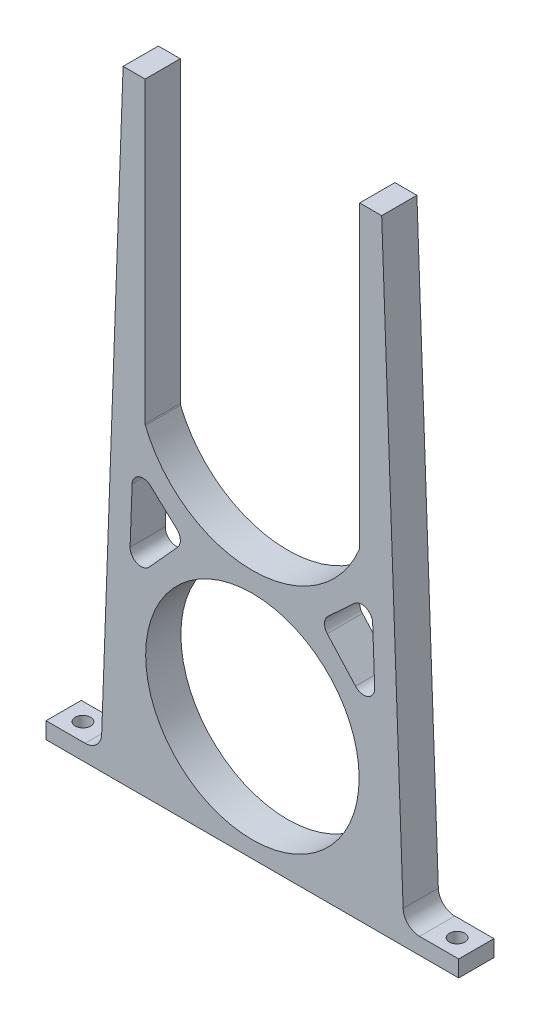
SolidWorks part; units mm, degrees
ref_plane "Front Plane" through (0, 0, 0) normal (0, 0, 1) x (1, 0, 0)
ref_plane "Top Plane" through (0, 0, 0) normal (0, 1, 0) x (1, 0, 0)
ref_plane "Right Plane" through (0, 0, 0) normal (1, 0, 0) x (0, 0, -1)
sketch "Sketch1" plane through (0, 0, 0) normal (0, 0, 1) x (1, 0, 0)
  line L0 (0, 0) -> (0, 93.2102) construction
  line L1 (-37.5, 0) -> (37.5, 0)
  line L2 (37.5, 0) -> (37.5, 3)
  line L3 (37.5, 3) -> (27.5, 3)
  line L4 (27.5, 3) -> (23.5, 113)
  line L5 (23.5, 113) -> (19.5, 113)
  line L6 (19.5, 113) -> (19.5, 58.6058)
  line L7 (-19.5, 113) -> (-19.5, 58.6058)
  line L8 (-23.5, 113) -> (-19.5, 113)
  line L9 (-27.5, 3) -> (-23.5, 113)
  line L10 (-37.5, 3) -> (-27.5, 3)
  line L11 (-37.5, 0) -> (-37.5, 3)
  arc A0 (19.5, 58.6058) -> (-19.5, 58.6058) centre (0, 66.4) cw
  circle A1 centre (0, 22.4) radius 19.4
  dimension "D4" = 21
  dimension "D8" = 19.4
  dimension "D10" = 44
  dimension "D1" = 4
  dimension "D2" = 3
  dimension "D3" = 37.5
  dimension "D5" = 110
  dimension "D6" = 19.5
  dimension "D7" = 10
  dimension "D9" = 19.4
extrude "Boss-Extrude1" add sketch "Sketch1" along normal mid plane 6.4
sketch "Sketch2" plane through (0, 0, 0) normal (0, 0, 1) x (1, 0, 0)
  line L0 (34, 3) -> (34, 0) construction
  line L1 (37.5, 3) -> (27.5, 3) construction
  line L2 (-37.5, 0) -> (37.5, 0) construction
  line L4 (35.4, 3) -> (35.4, 0)
  line L5 (37.5, 0) -> (37.5, 3) construction
  line L6 (35.4, 3) -> (34, 3)
  line L7 (34, 3) -> (34, 0)
  line L8 (34, 0) -> (35.4, 0)
  dimension "D1" = 1.4
  dimension "D2" = 3.5
revolve "Cut-Revolve1" cut sketch "Sketch2" angle 360 about L0
mirror "Mirror1" about plane through (0, 0, 0) normal (1, 0, 0) of "Cut-Revolve1"
fillet "Fillet1" radius 0.7 2 edges at (19.5, 58.6058, 0) (-19.5, 58.6058, 0)
fillet "Fillet2" radius 3 2 edges at (27.5, 3, 0) (-27.5, 3, 0)
sketch "Sketch3" plane through (0, 0, 0) normal (0, 0, 1) x (1, 0, 0)
  line L0 (12.286, 43.7011) -> (21.7001, 52.4253)
  line L1 (21.7001, 52.4253) -> (22.425, 32.4897)
  line L2 (22.425, 32.4897) -> (12.286, 43.7011)
  line L3 (27.3949, 5.891) -> (23.5, 113) construction
  line L4 (22.425, 32.4897) -> (0, 22.4) construction
  line L5 (0, 22.4) -> (12.286, 43.7011) construction
  line L6 (0, 66.4) -> (12.286, 43.7011) construction
  line L7 (12.286, 43.7011) -> (11.8945, 43.3541) construction
  line L8 (0, 66.4) -> (21.7001, 52.4253) construction
  line L9 (14.2741, 50.9971) -> (6.6687, 43.949) construction
  line L10 (6.6687, 43.949) -> (14.3887, 35.4125) construction
  arc A0 (-19.4483, 58.4776) -> (19.4483, 58.4776) centre (0, 66.4) ccw construction
  circle A1 centre (0, 22.4) radius 19.4 construction
  dimension "D1" = 4
  dimension "D2" = 4
  dimension "D3" = 4
extrude "Cut-Extrude1" cut sketch "Sketch3" against normal mid plane 10
fillet "Fillet3" radius 2 3 edges at (22.425, 32.4897, 0) (21.7001, 52.4253, 0) (12.286, 43.7011, 0)
mirror "Mirror2" about plane through (0, 0, 0) normal (1, 0, 0) of "Cut-Extrude1", "Fillet3"
